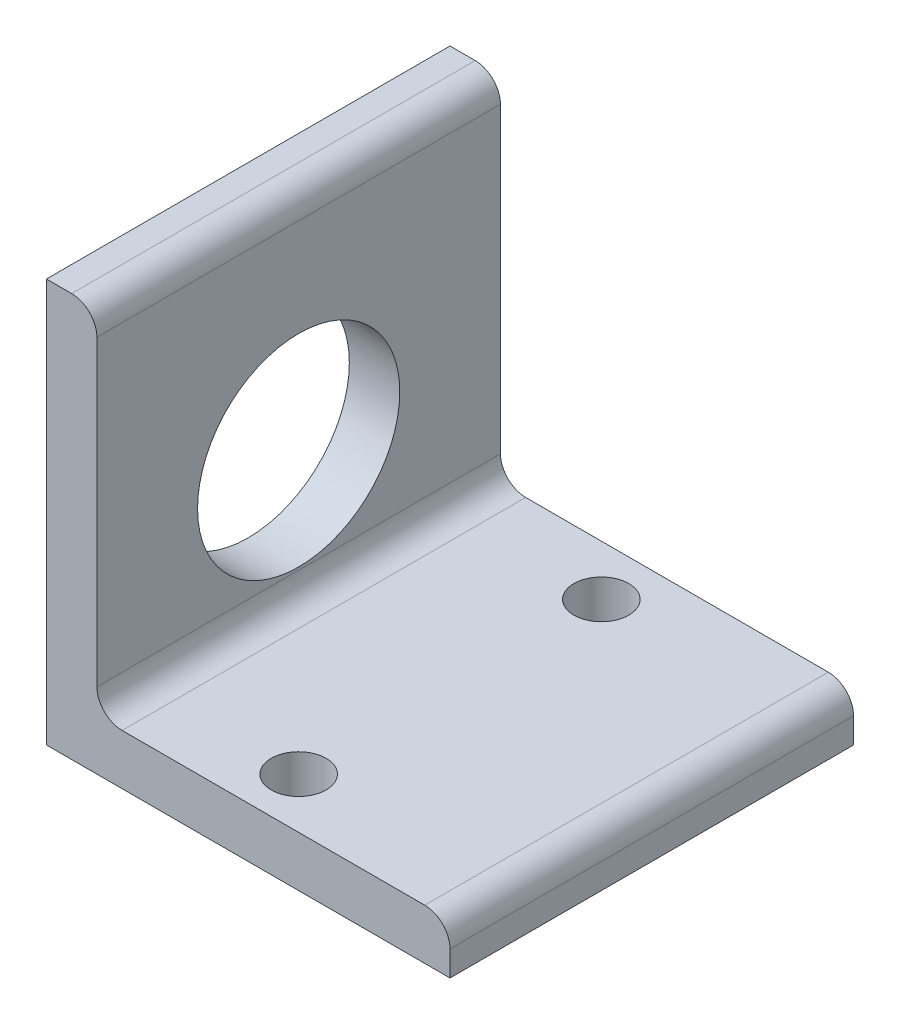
SolidWorks part; units mm, degrees
ref_plane "Front Plane" through (0, 0, 0) normal (0, 0, 1) x (1, 0, 0)
ref_plane "Top Plane" through (0, 0, 0) normal (0, 1, 0) x (1, 0, 0)
ref_plane "Right Plane" through (0, 0, 0) normal (1, 0, 0) x (0, 0, -1)
sketch "Sketch1" plane through (0, 0, 0) normal (0, 0, 1) x (1, 0, 0)
  line L0 (0, 25.4) -> (3.175, 25.4)
  line L1 (0, 0) -> (25.4, 0)
  line L2 (0, 0) -> (0, 25.4)
  line L7 (25.4, 3.175) -> (3.175, 3.175)
  line L8 (3.175, 25.4) -> (3.175, 3.175)
  line L9 (25.4, 3.175) -> (25.4, 0)
  dimension "D1" = 3.175
  dimension "D4" = 22.225
extrude "Boss-Extrude1" add sketch "Sketch1" along normal blind 25.4
hole_wizard "#4 Clearance Hole1" positions "Sketch5" profile "Sketch4" hole size "#4" standard "ANSI Inch"
sketch "Sketch5" plane through (0, 3.175, 0) normal (0, 1, 0) x (1, 0, 0)
  line L0 (12.7, -3.175) -> (12.7, -22.225) construction
  line L2 (0, -25.4) -> (0, 0) construction
  point P0 (12.7, -22.225)
  point P2 (12.7, -3.175)
  dimension "D1" = 12.7
  dimension "D3" = 3.175
  dimension "D4" = 22.225
sketch "Sketch4" plane through (12.7, 3.175, 22.225) normal (1, 0, 0) x (0, 0, 1)
  line L0 (0, 0) -> (0, 3.175)
  line L1 (0, 3.175) -> (1.7272, 3.175)
  line L2 (1.7272, 3.175) -> (1.7272, 0)
  line L5 (1.7272, 0) -> (0, 0)
  line L11 (0, -6.35) -> (0, 107.95) construction
  dimension "Thru Hole Dia." = 3.4544
  dimension "Thru Hole Depth" = 3.175
hole_wizard "3/8 (0.502) Diameter Hole1" positions "Sketch6" profile "Sketch7" hole size "3/8" standard "ANSI Inch"
sketch "Sketch6" plane through (0, 0, 0) normal (1, 0, 0) x (0, 0, -1)
  line L0 (0, 25.4) -> (0, 3.175) construction
  point P2 (-12.7, 11.303)
  dimension "D2" = 11.303
  dimension "D3" = 12.7
sketch "Sketch7" plane through (0, 11.303, 12.7) normal (0, 1, 0) x (0, 0, 1)
  line L0 (0, 0) -> (0, 25.4)
  line L1 (0, 25.4) -> (6.3627, 25.4)
  line L2 (6.3627, 25.4) -> (6.3627, 0)
  line L5 (6.3627, 0) -> (0, 0)
  line L11 (0, -6.35) -> (0, 107.95) construction
  dimension "Thru Hole Dia." = 12.7254
  dimension "Thru Hole Depth" = 25.4
fillet "Fillet2" radius 1.5875 3 edges at (3.175, 3.175, 12.7) (25.4, 3.175, 12.7) (3.175, 25.4, 12.7)
